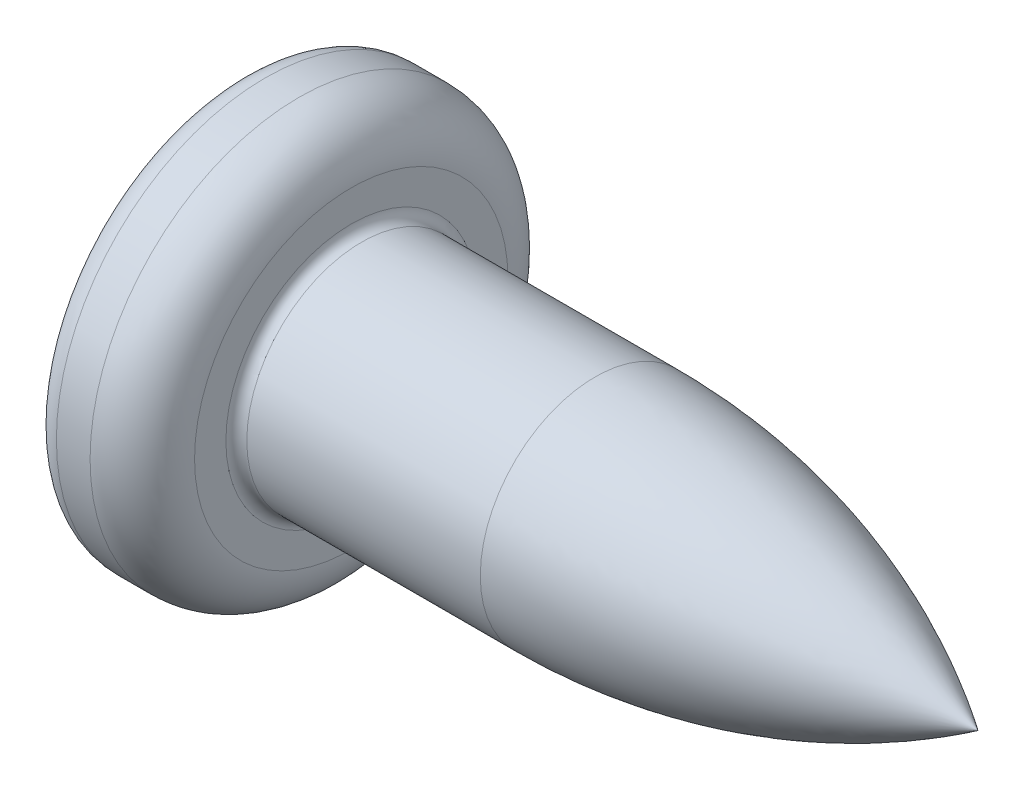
SolidWorks part; units mm, degrees
ref_plane "Plane1" through (0, 0, 0) normal (0, 0, 1) x (1, 0, 0)
ref_plane "Plane2" through (0, 0, 0) normal (0, 1, 0) x (1, 0, 0)
ref_plane "Plane3" through (0, 0, 0) normal (1, 0, 0) x (0, 0, -1)
revolve "Base-Revolve" add sketch "BodySke"
sketch "BodySke" plane through (0, 0, 0) normal (0, 0, 1) x (1, 0, 0)
  line L0 (1.5, 1.1) -> (1.5, 1.5)
  line L1 (1.725, 6.35) -> (1.725, -3.175) construction
  line L2 (-25.4, 0) -> (127, 0) construction
  line L3 (7.5, 0) -> (0, 0)
  line L4 (1.5, 1.1) -> (3.8354, 1.1)
  line L6 (0.6774, 2) -> (1, 2)
  line L8 (2.1, 6.35) -> (2.1, -3.175) construction
  arc A0 (0.4653, 1.8723) -> (0, 0) centre (4, 0) ccw
  arc A1 (7.5, 0) -> (3.8354, 1.1) centre (3.8354, -5.5544) ccw
  arc A2 (0.4653, 1.8723) -> (0.6774, 2) centre (0.6774, 1.76) cw
  arc A3 (1.5, 1.5) -> (1, 2) centre (1, 1.5) ccw
  point P19 (1.5, 2)
  dimension "Head_fillet_rad" = 0.24
  dimension "D3" = 0.5
  dimension "Head_crown_rad" = 4
  dimension "D1" = 1.1
  dimension "D2" = 6
  dimension "Head_ht" = 1.5
  dimension "Head_dia" = 4
  dimension "Advance" = 0.45
fillet "Fillet1" radius 0.1 1 edges at (1.5, 0, 1.1)
sketch "Sketch3" plane through (0, 0, 0) normal (1, 0, 0) x (0, 0, -1)
  line L0 (0.37, -1.3) -> (-0.37, -1.3)
  line L1 (0.37, -1.3) -> (0.37, 1.3)
  line L2 (-0.37, 1.3) -> (0.37, 1.3)
  line L3 (-0.37, 1.3) -> (-0.37, -1.3)
  dimension "D1" = 1.3
  dimension "Cross_dia" = 2.6
  dimension "D2" = 0.37
  dimension "Cross_width" = 0.74
ref_plane "Plane4" through (1.5, 0, 0) normal (1, 0, 0) x (0, 0, -1)
sketch "Sketch4" plane through (1.5, 0, 0) normal (1, 0, 0) x (0, 0, -1)
  line L0 (0.37, -0.5521) -> (-0.37, -0.5521)
  line L1 (0.37, -0.5521) -> (0.37, 0.5521)
  line L2 (-0.37, 0.5521) -> (0.37, 0.5521)
  line L3 (-0.37, 0.5521) -> (-0.37, -0.5521)
  dimension "D1" = 0.74
  dimension "D2" = 1.1043
  dimension "D3" = 0.37
  dimension "D4" = 0.5521
loft "Recess" cut profiles "Sketch3", "Sketch4"
pattern_circular "RecPat" count 2 every 90 about axis through (0, 0, 0) along (1, 0, 0) of "Recess"
sketch "RecCorSke" plane through (0, 0, 0) normal (0, 0, 1) x (1, 0, 0)
  line L0 (-3.175, 0) -> (15.875, 0) construction
  line L1 (-25.4, 0) -> (127, 0) construction
  line L2 (0, 0) -> (0, 0.6609)
  line L3 (0, 0.6609) -> (1.5, 0.556)
  line L4 (1.5, 0.556) -> (1.6807, 0)
  line L5 (1.6807, 0) -> (0, 0)
  dimension "Diameter" = 1.112
  dimension "Depth" = 1.5
  dimension "Draft_angle" = 4
  dimension "Bottom_angle" = 18
revolve "RecessCore" cut sketch "RecCorSke" angle 360 about L0
sketch "ThdSchSke" plane through (0, 0, 0) normal (0, 0, 1) x (1, 0, 0)
  line L0 (3, -0.9965) -> (2.8225, -1.25)
  line L1 (3, -0.9965) -> (3.1775, -1.25)
  line L2 (3.1775, -1.25) -> (3.1775, -1.5625)
  line L3 (-3.175, 0) -> (5.1513, 0) construction
  line L5 (3.1775, -1.5625) -> (2.8225, -1.5625)
  line L6 (2.8225, -1.5625) -> (2.8225, -1.25)
  dimension "Thread_minor" = 1.993
  dimension "Diameter" = 2.5
  dimension "Start" = 3
  dimension "SideAngle" = 55
  dimension "VeeAngle" = 70
  dimension "Overcut" = 3.125
revolve "ThreadSchematic" cut sketch "ThdSchSke" angle 360 about L3
pattern_linear "ThdSchPat"
